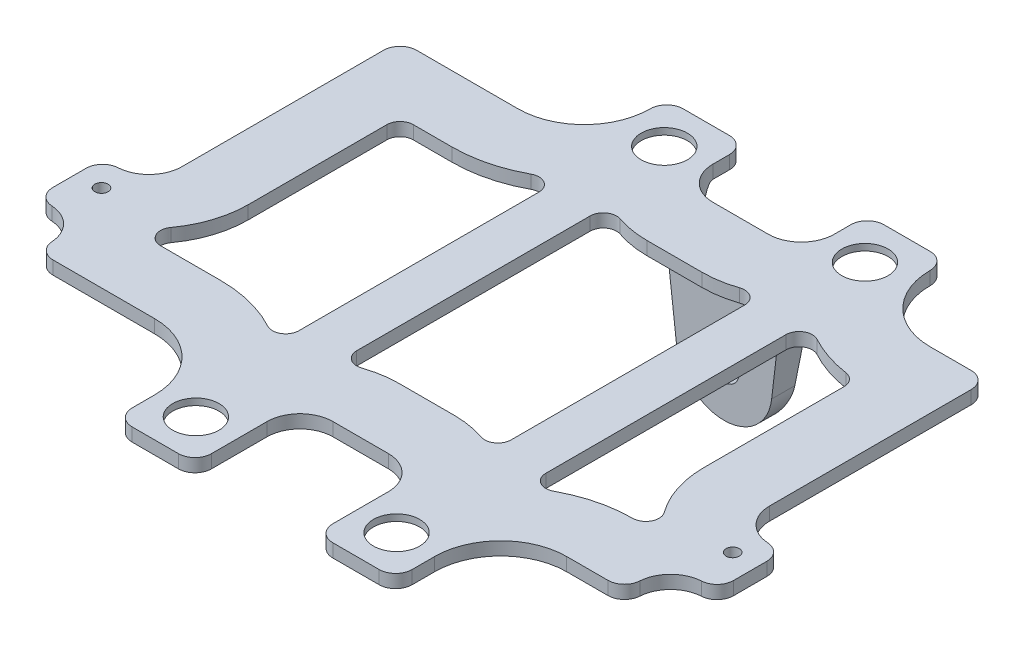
SolidWorks part; units mm, degrees
ref_plane "Front Plane" through (0, 0, 0) normal (0, 0, 1) x (1, 0, 0)
ref_plane "Top Plane" through (0, 0, 0) normal (0, 1, 0) x (1, 0, 0)
ref_plane "Right Plane" through (0, 0, 0) normal (1, 0, 0) x (0, 0, -1)
sketch "Sketch9"
  line L0 (46.99, 88.9) -> (46.99, 93.825) construction
  line L1 (32.2673, 87.1702) -> (116.9577, 87.1702) construction
  line L2 (116.9577, 87.1702) -> (116.9577, -2.8702) construction
  line L3 (116.9577, -2.8702) -> (32.2673, -2.8702) construction
  line L4 (46.99, 79.375) -> (46.99, 87.1702) construction
  line L5 (46.99, 87.1702) -> (102.235, 9.525) construction
  line L6 (102.235, 9.525) -> (102.235, -2.8702) construction
  line L7 (102.235, -2.8702) -> (102.235, 79.375) construction
  line L8 (46.99, 9.525) -> (46.99, 79.375) construction
  line L9 (46.99, 9.525) -> (46.99, -2.8702) construction
  line L10 (12.3317, 70.1675) -> (125.4125, 70.1675) construction
  line L11 (32.2673, 3.7846) -> (32.2673, 9.525) construction
  line L12 (32.2673, 80.5154) -> (32.2673, 79.375) construction
  line L13 (32.2673, 79.375) -> (32.2673, 70.1675) construction
  line L14 (32.2673, 9.525) -> (32.2673, 70.1675) construction
  line L15 (46.99, 8.509) -> (46.99, 9.525) construction
  line L16 (46.99, 9.525) -> (59.3217, 8.509) construction
  line L17 (59.3217, 8.509) -> (59.3217, 9.525) construction
  line L18 (102.235, 13.335) -> (102.235, 9.525) construction
  point P24 (102.235, 79.375)
other "AlignGroup1"
other "AlignGroup2"
other "AlignGroup3" parameters "D1"=0, "D2"=0, "D3"=19.5673, "D4"=77.2033, "D5"=89.535, "D6"=104.2577, "D7"=54.2925, "D8"=71.2952, "D9"=6.35, "D10"=7.366, "D11"=18.7452, "D12"=113.0808, "D13"=76.7308
other "AlignGroup4"
sketch "Sketch1" plane through (0, 0, 0) normal (0, 1, 0) x (1, 0, 0)
  line L0 (12.3317, 88.9) -> (12.3317, 0) construction
  line L1 (12.3317, 0) -> (119.8562, 0)
  line L2 (0, 0) -> (0, 88.9) construction
  line L3 (12.3317, 88.9) -> (119.8562, 88.9)
  line L4 (125.4125, 0) -> (125.4125, 88.9) construction
  line L5 (0, 88.9) -> (12.3317, 88.9) construction
  line L6 (0, 0) -> (12.3317, 0) construction
  line L7 (6.7754, 88.9) -> (6.7754, 0)
  line L8 (119.8562, 0) -> (119.8562, 88.9)
  line L9 (119.8562, 88.9) -> (125.4125, 88.9) construction
  line L10 (119.8562, 0) -> (125.4125, 0) construction
  line L11 (6.7754, 0) -> (12.3317, 0)
  line L12 (6.7754, 88.9) -> (12.3317, 88.9)
  dimension "D1" = 5.5562
  dimension "D2" = 88.9
  dimension "D3" = 5.5562
extrude "Boss-Extrude1" add sketch "Sketch1" along normal blind 2.54
sketch "Sketch2" plane through (0, 2.54, 0) normal (0, 1, 0) x (1, 0, 0)
  line L0 (6.7754, 0) -> (119.8562, 0) construction
  line L1 (6.7754, 88.9) -> (39.37, 88.9)
  line L2 (0, 88.9) -> (0, 79.375) construction
  line L3 (6.7754, 79.375) -> (39.37, 79.375)
  line L4 (39.37, 88.9) -> (39.37, 79.375)
  line L5 (119.8562, 88.9) -> (93.1862, 88.9)
  line L6 (119.8562, 88.9) -> (119.8562, 79.375)
  line L7 (119.8562, 79.375) -> (93.1862, 79.375)
  line L8 (93.1862, 88.9) -> (93.1862, 79.375)
  line L9 (119.8562, 0) -> (93.1862, 0)
  line L10 (119.8562, 0) -> (119.8562, 9.525)
  line L11 (119.8562, 9.525) -> (93.1862, 9.525)
  line L12 (93.1862, 0) -> (93.1862, 9.525)
  line L13 (39.37, 0) -> (6.7754, 0)
  line L14 (39.37, 0) -> (39.37, 9.525)
  line L15 (39.37, 9.525) -> (6.7754, 9.525)
  line L16 (0, 0) -> (0, 9.525) construction
  line L18 (39.37, 79.375) -> (39.37, 9.525) construction
  line L19 (93.1862, 9.525) -> (93.1862, 79.375) construction
  line L20 (93.1862, 9.525) -> (39.37, 9.525) construction
  line L21 (39.37, 79.375) -> (93.1862, 79.375) construction
  line L22 (119.8562, 88.9) -> (6.7754, 88.9) construction
  line L23 (77.9462, 9.525) -> (54.61, 9.525)
  line L24 (77.9462, 9.525) -> (77.9462, 0)
  line L25 (77.9462, 0) -> (54.61, 0)
  line L26 (54.61, 9.525) -> (54.61, 0)
  line L27 (54.61, 88.9) -> (77.9462, 88.9)
  line L28 (54.61, 88.9) -> (54.61, 79.375)
  line L29 (54.61, 79.375) -> (77.9462, 79.375)
  line L30 (77.9462, 88.9) -> (77.9462, 79.375)
  line L31 (77.9462, 9.525) -> (77.9462, 79.375) construction
  line L32 (54.61, 9.525) -> (54.61, 79.375) construction
  line L33 (6.7754, 88.9) -> (6.7754, 79.375)
  line L35 (6.7754, 9.525) -> (6.7754, 0)
  line L36 (6.7754, 9.525) -> (0, 9.525) construction
  line L37 (6.7754, 0) -> (0, 0) construction
  line L38 (0, 79.375) -> (6.7754, 79.375) construction
  line L39 (0, 88.9) -> (6.7754, 88.9) construction
  line L40 (0, 9.525) -> (0, 79.375) construction
  line L41 (6.7754, 88.9) -> (6.7754, 0) construction
  line L42 (119.8562, 0) -> (119.8562, 88.9) construction
  line L43 (6.7754, 0) -> (119.8562, 0) construction
  point P40 (66.2781, 9.525)
  dimension "D1" = 9.525
  dimension ".375" = 9.525
  dimension "D2" = 26.67
  dimension "D3" = 32.5946
  dimension "D4" = 15.24
extrude "Cut-Extrude1" cut sketch "Sketch2" against normal through all
sketch "Sketch4" plane through (0, 2.54, 0) normal (0, 1, 0) x (1, 0, 0)
  line L63 (59.9281, 0) -> (59.9281, 88.9) construction
  line L66 (152.7185, 14.2875) -> (143.1935, 14.2875) construction
  line L67 (154.306, 14.2875) -> (152.7185, 14.2875) construction
  line L68 (143.1935, 14.2875) -> (141.606, 14.2875) construction
  line L69 (152.7185, 20.32) -> (143.1935, 20.32) construction
  line L70 (154.306, 20.32) -> (152.7185, 20.32) construction
  line L71 (143.1935, 20.32) -> (141.606, 20.32) construction
  line L72 (152.7185, 26.3525) -> (143.1935, 26.3525) construction
  line L73 (154.306, 26.3525) -> (152.7185, 26.3525) construction
  line L74 (143.1935, 26.3525) -> (141.606, 26.3525) construction
  line L75 (152.7185, 32.385) -> (143.1935, 32.385) construction
  line L76 (154.306, 32.385) -> (152.7185, 32.385) construction
  line L77 (143.1935, 32.385) -> (141.606, 32.385) construction
  line L78 (152.7185, 38.4175) -> (143.1935, 38.4175) construction
  line L79 (154.306, 38.4175) -> (152.7185, 38.4175) construction
  line L80 (143.1935, 38.4175) -> (141.606, 38.4175) construction
  line L81 (152.7185, 44.45) -> (143.1935, 44.45) construction
  line L82 (154.306, 44.45) -> (152.7185, 44.45) construction
  line L83 (143.1935, 44.45) -> (141.606, 44.45) construction
  line L84 (152.7185, 50.4825) -> (143.1935, 50.4825) construction
  line L85 (154.306, 50.4825) -> (152.7185, 50.4825) construction
  line L86 (143.1935, 50.4825) -> (141.606, 50.4825) construction
  line L87 (152.7185, 56.515) -> (143.1935, 56.515) construction
  line L88 (154.306, 56.515) -> (152.7185, 56.515) construction
  line L89 (143.1935, 56.515) -> (141.606, 56.515) construction
  line L90 (152.7185, 62.5475) -> (143.1935, 62.5475) construction
  line L91 (154.306, 62.5475) -> (152.7185, 62.5475) construction
  line L92 (143.1935, 62.5475) -> (141.606, 62.5475) construction
  line L93 (152.7185, 68.58) -> (143.1935, 68.58) construction
  line L94 (154.306, 68.58) -> (152.7185, 68.58) construction
  line L95 (143.1935, 68.58) -> (141.606, 68.58) construction
  line L96 (152.7185, 74.6125) -> (143.1935, 74.6125) construction
  line L97 (154.306, 74.6125) -> (152.7185, 74.6125) construction
  line L98 (143.1935, 74.6125) -> (141.606, 74.6125) construction
  line L99 (154.306, 15.875) -> (141.606, 15.875) construction
  line L100 (141.606, 12.7) -> (154.306, 12.7) construction
  line L101 (154.306, 21.9075) -> (141.606, 21.9075) construction
  line L102 (141.606, 18.7325) -> (154.306, 18.7325) construction
  line L103 (154.306, 27.94) -> (141.606, 27.94) construction
  line L104 (141.606, 24.765) -> (154.306, 24.765) construction
  line L105 (154.306, 33.9725) -> (141.606, 33.9725) construction
  line L106 (141.606, 30.7975) -> (154.306, 30.7975) construction
  line L107 (154.306, 40.005) -> (141.606, 40.005) construction
  line L108 (141.606, 36.83) -> (154.306, 36.83) construction
  line L109 (154.306, 46.0375) -> (141.606, 46.0375) construction
  line L110 (141.606, 42.8625) -> (154.306, 42.8625) construction
  line L111 (154.306, 52.07) -> (141.606, 52.07) construction
  line L112 (141.606, 48.895) -> (154.306, 48.895) construction
  line L113 (154.306, 58.1025) -> (141.606, 58.1025) construction
  line L114 (141.606, 54.9275) -> (154.306, 54.9275) construction
  line L115 (154.306, 64.135) -> (141.606, 64.135) construction
  line L116 (141.606, 60.96) -> (154.306, 60.96) construction
  line L117 (154.306, 70.1675) -> (141.606, 70.1675) construction
  line L118 (141.606, 66.9925) -> (154.306, 66.9925) construction
  line L119 (154.306, 76.2) -> (141.606, 76.2) construction
  line L120 (141.606, 73.025) -> (154.306, 73.025) construction
  line L121 (77.9462, 0) -> (54.61, 0) construction
  line L122 (140.0185, 14.2875) -> (140.0185, 74.6125) construction
  line L123 (85.5662, 0) -> (85.5662, 17.4625) construction
  line L124 (77.9462, 0) -> (93.1862, 0) construction
  line L125 (85.5662, 17.4625) -> (85.5662, 71.4375) construction
  line L126 (85.5662, 71.4375) -> (85.5662, 88.9) construction
  line L127 (93.1862, 88.9) -> (77.9462, 88.9) construction
  arc A66 (143.1935, 14.2875) -> (141.606, 12.7) centre (141.606, 14.2875) cw construction
  arc A67 (141.606, 15.875) -> (143.1935, 14.2875) centre (141.606, 14.2875) cw construction
  arc A68 (152.7185, 14.2875) -> (154.306, 15.875) centre (154.306, 14.2875) cw construction
  arc A69 (154.306, 12.7) -> (152.7185, 14.2875) centre (154.306, 14.2875) cw construction
  arc A70 (143.1935, 20.32) -> (141.606, 18.7325) centre (141.606, 20.32) cw construction
  arc A71 (141.606, 21.9075) -> (143.1935, 20.32) centre (141.606, 20.32) cw construction
  arc A72 (152.7185, 20.32) -> (154.306, 21.9075) centre (154.306, 20.32) cw construction
  arc A73 (154.306, 18.7325) -> (152.7185, 20.32) centre (154.306, 20.32) cw construction
  arc A74 (143.1935, 26.3525) -> (141.606, 24.765) centre (141.606, 26.3525) cw construction
  arc A75 (141.606, 27.94) -> (143.1935, 26.3525) centre (141.606, 26.3525) cw construction
  arc A76 (152.7185, 26.3525) -> (154.306, 27.94) centre (154.306, 26.3525) cw construction
  arc A77 (154.306, 24.765) -> (152.7185, 26.3525) centre (154.306, 26.3525) cw construction
  arc A78 (143.1935, 32.385) -> (141.606, 30.7975) centre (141.606, 32.385) cw construction
  arc A79 (141.606, 33.9725) -> (143.1935, 32.385) centre (141.606, 32.385) cw construction
  arc A80 (152.7185, 32.385) -> (154.306, 33.9725) centre (154.306, 32.385) cw construction
  arc A81 (154.306, 30.7975) -> (152.7185, 32.385) centre (154.306, 32.385) cw construction
  arc A82 (143.1935, 38.4175) -> (141.606, 36.83) centre (141.606, 38.4175) cw construction
  arc A83 (141.606, 40.005) -> (143.1935, 38.4175) centre (141.606, 38.4175) cw construction
  arc A84 (152.7185, 38.4175) -> (154.306, 40.005) centre (154.306, 38.4175) cw construction
  arc A85 (154.306, 36.83) -> (152.7185, 38.4175) centre (154.306, 38.4175) cw construction
  arc A86 (143.1935, 44.45) -> (141.606, 42.8625) centre (141.606, 44.45) cw construction
  arc A87 (141.606, 46.0375) -> (143.1935, 44.45) centre (141.606, 44.45) cw construction
  arc A88 (152.7185, 44.45) -> (154.306, 46.0375) centre (154.306, 44.45) cw construction
  arc A89 (154.306, 42.8625) -> (152.7185, 44.45) centre (154.306, 44.45) cw construction
  arc A90 (143.1935, 50.4825) -> (141.606, 48.895) centre (141.606, 50.4825) cw construction
  arc A91 (141.606, 52.07) -> (143.1935, 50.4825) centre (141.606, 50.4825) cw construction
  arc A92 (152.7185, 50.4825) -> (154.306, 52.07) centre (154.306, 50.4825) cw construction
  arc A93 (154.306, 48.895) -> (152.7185, 50.4825) centre (154.306, 50.4825) cw construction
  arc A94 (143.1935, 56.515) -> (141.606, 54.9275) centre (141.606, 56.515) cw construction
  arc A95 (141.606, 58.1025) -> (143.1935, 56.515) centre (141.606, 56.515) cw construction
  arc A96 (152.7185, 56.515) -> (154.306, 58.1025) centre (154.306, 56.515) cw construction
  arc A97 (154.306, 54.9275) -> (152.7185, 56.515) centre (154.306, 56.515) cw construction
  arc A98 (143.1935, 62.5475) -> (141.606, 60.96) centre (141.606, 62.5475) cw construction
  arc A99 (141.606, 64.135) -> (143.1935, 62.5475) centre (141.606, 62.5475) cw construction
  arc A100 (152.7185, 62.5475) -> (154.306, 64.135) centre (154.306, 62.5475) cw construction
  arc A101 (154.306, 60.96) -> (152.7185, 62.5475) centre (154.306, 62.5475) cw construction
  arc A102 (143.1935, 68.58) -> (141.606, 66.9925) centre (141.606, 68.58) cw construction
  arc A103 (141.606, 70.1675) -> (143.1935, 68.58) centre (141.606, 68.58) cw construction
  arc A104 (152.7185, 68.58) -> (154.306, 70.1675) centre (154.306, 68.58) cw construction
  arc A105 (154.306, 66.9925) -> (152.7185, 68.58) centre (154.306, 68.58) cw construction
  arc A106 (143.1935, 74.6125) -> (141.606, 73.025) centre (141.606, 74.6125) cw construction
  arc A107 (141.606, 76.2) -> (143.1935, 74.6125) centre (141.606, 74.6125) cw construction
  arc A108 (152.7185, 74.6125) -> (154.306, 76.2) centre (154.306, 74.6125) cw construction
  arc A109 (154.306, 73.025) -> (152.7185, 74.6125) centre (154.306, 74.6125) cw construction
  arc A110 (141.606, 12.7) -> (141.606, 15.875) centre (141.606, 14.2875) cw construction
  arc A111 (154.306, 15.875) -> (154.306, 12.7) centre (154.306, 14.2875) cw construction
  arc A112 (141.606, 18.7325) -> (141.606, 21.9075) centre (141.606, 20.32) cw construction
  arc A113 (154.306, 21.9075) -> (154.306, 18.7325) centre (154.306, 20.32) cw construction
  arc A114 (141.606, 24.765) -> (141.606, 27.94) centre (141.606, 26.3525) cw construction
  arc A115 (154.306, 27.94) -> (154.306, 24.765) centre (154.306, 26.3525) cw construction
  arc A116 (141.606, 30.7975) -> (141.606, 33.9725) centre (141.606, 32.385) cw construction
  arc A117 (154.306, 33.9725) -> (154.306, 30.7975) centre (154.306, 32.385) cw construction
  arc A118 (141.606, 36.83) -> (141.606, 40.005) centre (141.606, 38.4175) cw construction
  arc A119 (154.306, 40.005) -> (154.306, 36.83) centre (154.306, 38.4175) cw construction
  arc A120 (141.606, 42.8625) -> (141.606, 46.0375) centre (141.606, 44.45) cw construction
  arc A121 (154.306, 46.0375) -> (154.306, 42.8625) centre (154.306, 44.45) cw construction
  arc A122 (141.606, 48.895) -> (141.606, 52.07) centre (141.606, 50.4825) cw construction
  arc A123 (154.306, 52.07) -> (154.306, 48.895) centre (154.306, 50.4825) cw construction
  arc A124 (141.606, 54.9275) -> (141.606, 58.1025) centre (141.606, 56.515) cw construction
  arc A125 (154.306, 58.1025) -> (154.306, 54.9275) centre (154.306, 56.515) cw construction
  arc A126 (141.606, 60.96) -> (141.606, 64.135) centre (141.606, 62.5475) cw construction
  arc A127 (154.306, 64.135) -> (154.306, 60.96) centre (154.306, 62.5475) cw construction
  arc A128 (141.606, 66.9925) -> (141.606, 70.1675) centre (141.606, 68.58) cw construction
  arc A129 (154.306, 70.1675) -> (154.306, 66.9925) centre (154.306, 68.58) cw construction
  arc A130 (141.606, 73.025) -> (141.606, 76.2) centre (141.606, 74.6125) cw construction
  arc A131 (154.306, 76.2) -> (154.306, 73.025) centre (154.306, 74.6125) cw construction
  point P8 (53.5781, 0)
  point P11 (66.2781, 0)
  point P214 (155.8935, 14.2875)
  point P215 (155.8935, 20.32)
  point P216 (155.8935, 26.3525)
  point P217 (155.8935, 32.385)
  point P218 (155.8935, 38.4175)
  point P219 (155.8935, 44.45)
  point P220 (155.8935, 50.4825)
  point P221 (155.8935, 56.515)
  point P222 (155.8935, 62.5475)
  point P223 (155.8935, 68.58)
  point P224 (155.8935, 74.6125)
  dimension "D7" = 6.35
  dimension "D8" = 6.35
sketch "Sketch5" plane through (0, 0, -79.375) normal (0, 0, -1) x (-1, 0, 0)
  line L0 (-77.9462, 0) -> (-77.9462, 2.54) construction
  line L1 (-54.61, 2.54) -> (-77.9462, 2.54)
  line L5 (-54.61, 2.54) -> (-77.9462, 2.54) construction
  line L6 (-77.9462, 2.54) -> (-77.9462, 0)
  line L7 (-77.9462, 0) -> (-75.4222, -21.3986)
  line L9 (-66.2781, 2.54) -> (-66.2781, 17.007) construction
  line L10 (-66.2781, 2.54) -> (-66.2781, -17.4625) construction
  line L11 (-54.61, 0) -> (-77.9462, 0) construction
  line L12 (-66.2781, -23.1775) -> (-66.2781, -25.273) construction
  line L13 (-54.61, 2.54) -> (-54.61, 0)
  line L14 (-54.61, 0) -> (-57.134, -21.3986)
  arc A0 (-75.4222, -21.3986) -> (-57.134, -21.3986) centre (-66.2781, -20.32) ccw
  circle A1 centre (-66.2781, -20.32) radius 2.8575
  dimension "D2" = 5.715
  dimension "D3" = 6.35
  dimension "D1" = 20.32
extrude "Boss-Extrude2" add sketch "Sketch5" along normal blind 3.175
sketch "Sketch10" plane through (0, 2.54, 0) normal (0, 1, 0) x (1, 0, 0)
  line L0 (6.7754, 79.375) -> (39.37, 79.375) construction
  line L1 (6.7754, 9.525) -> (3.9973, 9.525)
  line L2 (6.7754, 9.525) -> (6.7754, 79.375)
  line L3 (6.7754, 79.375) -> (3.9973, 79.375)
  line L4 (3.9973, 9.525) -> (3.9973, 79.375)
  dimension "D1" = 2.7781
extrude "Boss-Extrude3" add sketch "Sketch10" against normal up to vertex
sketch "Sketch12" plane through (0, 2.54, 0) normal (0, 1, 0) x (1, 0, 0)
  line L0 (77.9462, -10.6654) -> (54.61, -10.6654) construction
  line L1 (39.37, 0) -> (54.61, 0)
  line L2 (39.37, 0) -> (39.37, -10.6654)
  line L3 (39.37, -10.6654) -> (54.61, -10.6654)
  line L4 (54.61, 0) -> (54.61, -10.6654)
  line L5 (77.9462, 0) -> (93.1862, 0)
  line L6 (77.9462, 0) -> (77.9462, -10.6654)
  line L7 (77.9462, -10.6654) -> (93.1862, -10.6654)
  line L8 (93.1862, 0) -> (93.1862, -10.6654)
  line L9 (54.61, 88.9) -> (54.61, 82.55) construction
  line L10 (39.37, 88.9) -> (54.61, 88.9)
  line L11 (39.37, 88.9) -> (39.37, 95.25)
  line L12 (39.37, 95.25) -> (54.61, 95.25)
  line L13 (54.61, 88.9) -> (54.61, 95.25)
  line L14 (77.9462, 95.25) -> (93.1862, 95.25)
  line L15 (77.9462, 95.25) -> (77.9462, 88.9)
  line L16 (77.9462, 88.9) -> (93.1862, 88.9)
  line L17 (93.1862, 95.25) -> (93.1862, 88.9)
  line L18 (77.9462, 82.55) -> (77.9462, 88.9) construction
  line L19 (93.1862, 88.9) -> (77.9462, 88.9) construction
  dimension "D1" = 10.6654
  dimension "D2" = 6.35
  dimension "D3" = 6.35
extrude "Boss-Extrude4" add sketch "Sketch12" against normal up to surface (2.54 mm away) contours L6 L7 L8 L5
sketch "Sketch11" plane through (0, 2.54, 0) normal (0, 1, 0) x (1, 0, 0)
  line L0 (116.9577, 87.1702) -> (116.9577, -2.8702) construction
  line L1 (119.8562, 79.375) -> (116.9577, 79.375)
  line L2 (119.8562, 79.375) -> (119.8562, 9.525)
  line L3 (119.8562, 9.525) -> (116.9577, 9.525)
  line L4 (116.9577, 79.375) -> (116.9577, 9.525)
  line L5 (119.8562, 9.525) -> (93.1862, 9.525) construction
extrude "Cut-Extrude4" cut sketch "Sketch11" against normal through all
sketch "Sketch6"
  line L0 (39.37, -10.6654) -> (39.37, 9.525) construction
  line L1 (93.1862, 9.525) -> (93.1862, -10.6654) construction
  line L2 (46.99, 90.7721) -> (46.99, 95.25) construction
  line L3 (46.99, -10.2385) -> (85.5662, -10.2385) construction
  line L4 (85.5662, -10.2385) -> (85.5662, -7.3152) construction
  line L5 (85.5662, -2.8702) -> (85.5662, 87.1702) construction
  line L6 (93.1862, -10.6654) -> (77.9462, -10.6654) construction
  line L7 (85.5703, 40.8781) -> (46.9859, 40.8781) construction
  line L8 (77.9462, 95.25) -> (93.1862, 95.25) construction
  line L9 (54.61, 82.0488) -> (54.61, 82.55) construction
  line L10 (46.99, 87.1702) -> (85.5662, 87.1702) construction
  line L11 (85.5662, 95.25) -> (85.5662, 90.7721) construction
  line L12 (46.99, -2.8702) -> (46.99, -10.2385) construction
  line L13 (85.5662, -7.3152) -> (46.99, -7.3152) construction
  line L14 (66.2781, 40.8781) -> (66.2781, 77.7081) construction
  line L15 (46.99, -2.8702) -> (85.5662, -2.8702) construction
  line L16 (39.37, 79.375) -> (39.37, 95.25) construction
  line L17 (93.1862, 95.25) -> (93.1862, 79.375) construction
  line L20 (23.9329, 87.1702) -> (23.9329, -2.4433) construction
  line L21 (23.9329, -2.4433) -> (108.6233, -2.4433) construction
  line L22 (108.6233, -2.4433) -> (108.6233, 87.1702) construction
  line L23 (108.6233, 87.1702) -> (23.9329, 87.1702) construction
  line L24 (46.99, 87.1702) -> (85.5662, 87.1702) construction
  line L25 (85.5662, 87.1702) -> (85.5662, -2.8702) construction
  line L26 (85.5662, -2.8702) -> (46.99, -2.8702) construction
  line L29 (116.9577, 79.375) -> (116.9577, 9.525) construction
  line L30 (93.1862, 79.375) -> (116.9577, 79.375) construction
  circle A4 centre (46.99, -2.8702) radius 4.445
  circle A5 centre (85.5662, -2.8702) radius 4.445
  circle A6 centre (85.5662, 87.1702) radius 4.445
  circle A7 centre (46.99, 87.1702) radius 4.445
  point P6 (85.5662, -5.7606)
other "AlignGroup7" parameters "D1"=6.3714, "D3"=6.35, "D9"=8.89, "D2"=38.5762, "D4"=84.6904, "D5"=84.6904, "D6"=7.62, "D7"=0, "D8"=0, "D10"=8.3344, "D11"=50.6796, "D12"=62.3477, "D13"=93.0248, "D14"=15.875, "D15"=38.4969, "D16"=81.8183, "D17"=85.1356, "D18"=89.6135
other "AlignGroup8"
extrude "Cut-Extrude3" cut sketch "Sketch6" against normal up to next
sketch "Sketch13" plane through (0, 2.54, 0) normal (0, 1, 0) x (1, 0, 0)
  line L0 (3.9973, 79.375) -> (3.9973, 9.525) construction
  line L1 (3.9973, 31.115) -> (-4.9496, 31.115)
  line L2 (3.9973, 31.115) -> (3.9973, 18.415)
  line L3 (3.9973, 18.415) -> (-4.9496, 18.415)
  line L4 (-4.9496, 31.115) -> (-4.9496, 18.415)
  line L5 (0, 0) -> (-0.1871, 0) construction
  line L6 (116.9577, 79.375) -> (116.9577, 9.525) construction
  line L7 (116.9577, 31.115) -> (125.9046, 31.115)
  line L8 (116.9577, 31.115) -> (116.9577, 18.415)
  line L9 (116.9577, 18.415) -> (125.9046, 18.415)
  line L10 (125.9046, 31.115) -> (125.9046, 18.415)
  line L11 (-0.1871, 26.162) -> (-0.1871, 0) construction
  line L13 (39.37, 9.525) -> (3.9973, 9.525) construction
  line L14 (116.9577, 9.525) -> (93.1862, 9.525) construction
  circle A0 centre (-0.1871, 26.162) radius 1.27
  circle A1 centre (121.1421, 26.162) radius 1.27
  dimension "D1" = 2.54
  dimension "D2" = 12.7
  dimension "D3" = 8.9469
  dimension "D4" = 26.162
  dimension "D5" = 12.7
  dimension "D6" = 0.1871
  dimension "D7" = 121.1421
  dimension "D8" = 26.162
  dimension "D9" = 4.953
  dimension "D10" = 8.89
  dimension "D11" = 8.89
  dimension "D12" = 8.9469
extrude "Boss-Extrude5" add sketch "Sketch13" against normal up to surface (2.54 mm away)
fillet "Fillet2" radius 6.35 8 edges at (3.9973, 1.27, -31.115) (3.9973, 1.27, -18.415) (116.9577, 1.27, -18.415) (116.9577, 1.27, -31.115) (77.9462, 1.27, -82.55) (54.61, 1.27, -82.55) (54.61, 1.27, -9.525) (77.9462, 1.27, -9.525)
fillet "Fillet3" radius 12.7 4 edges at (39.37, 1.27, -79.375) (93.1862, 1.27, -79.375) (93.1862, 1.27, -9.525) (39.37, 1.27, -9.525)
fillet "Fillet4" radius 3.175 16 edges at (3.9973, 1.27, -79.375) (39.37, 1.27, -95.25) (54.61, 1.27, -95.25) (93.1862, 1.27, -95.25) (77.9462, 1.27, -95.25) (116.9577, 1.27, -79.375) (125.9046, 1.27, -31.115) (125.9046, 1.27, -18.415) (93.1862, 1.27, 10.6654) (77.9462, 1.27, 10.6654) (54.61, 1.27, 10.6654) (39.37, 1.27, 10.6654) (-4.9496, 1.27, -31.115) (-4.9496, 1.27, -18.415) (116.9577, 1.27, -9.525) (3.9973, 1.27, -9.525)
sketch "Sketch14" plane through (0, 0, 0) normal (0, -1, 0) x (1, 0, 0)
  circle A0 centre (46.99, 2.8702) radius 7.493
  circle A1 centre (85.5662, 2.8702) radius 7.493
  circle A2 centre (85.5662, -87.1702) radius 7.493
  circle A3 centre (46.99, -87.1702) radius 7.493
  dimension "D1" = 14.986
extrude "Cut-Extrude5" cut sketch "Sketch14" against normal blind 1.27
sketch "Sketch15" plane through (0, 2.54, 0) normal (0, 1, 0) x (1, 0, 0)
  line L0 (51.435, -2.8702) -> (81.1212, -2.8702) construction
  line L1 (90.0112, 87.1702) -> (90.0112, 72.2471) construction
  line L2 (81.1212, 87.1702) -> (81.1212, 72.4022) construction
  line L3 (51.435, 87.1702) -> (51.435, 72.4022) construction
  line L4 (42.545, 87.1702) -> (42.545, 72.2471) construction
  line L5 (90.0112, 16.6529) -> (90.0112, -2.8702) construction
  line L6 (81.1212, 19.6728) -> (81.1212, -2.8702) construction
  line L7 (51.435, 19.6728) -> (51.435, -2.8702) construction
  line L8 (42.545, 16.6529) -> (42.545, -2.8702) construction
  line L41 (42.545, 87.1702) -> (51.435, 87.1702) construction
  line L42 (42.545, 72.2471) -> (42.545, 16.6529)
  line L43 (42.545, -2.8702) -> (51.435, -2.8702) construction
  line L44 (51.435, 72.4022) -> (51.435, 19.6728)
  line L45 (81.1212, 87.1702) -> (90.0112, 87.1702) construction
  line L46 (81.1212, 72.4022) -> (81.1212, 19.6728)
  line L47 (81.1212, -2.8702) -> (90.0112, -2.8702) construction
  line L48 (90.0112, 72.2471) -> (90.0112, 16.6529)
  line L60 (26.67, 66.675) -> (16.6973, 66.675)
  line L61 (16.6973, 66.675) -> (16.6973, 37.465)
  line L62 (13.7618, 22.225) -> (26.67, 22.225)
  line L63 (60.96, 22.225) -> (71.5962, 22.225)
  line L64 (105.8862, 22.225) -> (107.1932, 22.225)
  line L65 (104.2577, 37.465) -> (104.2577, 66.7273)
  line L66 (71.5962, 69.85) -> (60.96, 69.85)
  line L67 (26.67, 66.675) -> (16.6973, 66.675)
  line L68 (16.6973, 66.675) -> (16.6973, 37.465)
  line L69 (13.7618, 22.225) -> (26.67, 22.225)
  line L70 (60.96, 22.225) -> (71.5962, 22.225)
  line L71 (105.8862, 22.225) -> (107.1932, 22.225)
  line L72 (104.2577, 37.465) -> (104.2577, 66.7273)
  line L73 (71.5962, 69.85) -> (60.96, 69.85)
  arc A0 (46.6223, 76.3567) -> (51.435, 72.4022) centre (60.96, 88.9) ccw construction
  arc A1 (42.545, 72.2471) -> (46.6223, 76.3567) centre (26.67, 92.075) ccw construction
  arc A2 (81.1212, 72.4022) -> (85.9339, 76.3567) centre (71.5962, 88.9) ccw construction
  arc A3 (85.9339, 76.3567) -> (90.0112, 72.2471) centre (105.8862, 92.075) ccw construction
  arc A4 (51.435, 19.6728) -> (45.3268, 14.0611) centre (60.96, 3.175) ccw construction
  arc A5 (45.3268, 14.0611) -> (42.545, 16.6529) centre (26.67, -3.175) ccw construction
  arc A6 (87.2294, 14.0611) -> (81.1212, 19.6728) centre (71.5962, 3.175) ccw construction
  arc A7 (90.0112, 16.6529) -> (87.2294, 14.0611) centre (105.8862, -3.175) ccw construction
  circle A56 centre (46.99, 87.1702) radius 4.445 construction
  circle A57 centre (46.99, -2.8702) radius 4.445 construction
  circle A58 centre (85.5662, 87.1702) radius 4.445 construction
  circle A59 centre (85.5662, -2.8702) radius 4.445 construction
  arc A84 (11.8464, 24.765) -> (16.6973, 37.465) centre (-2.3527, 37.465) ccw
  arc A85 (45.3268, 14.0611) -> (26.67, 22.225) centre (26.67, -3.175) ccw
  arc A86 (60.96, 22.225) -> (45.3268, 14.0611) centre (60.96, 3.175) ccw
  arc A87 (87.2294, 14.0611) -> (71.5962, 22.225) centre (71.5962, 3.175) ccw
  arc A88 (105.8862, 22.225) -> (87.2294, 14.0611) centre (105.8862, -3.175) ccw
  arc A89 (104.2577, 37.465) -> (109.1087, 24.765) centre (123.3077, 37.465) ccw
  arc A90 (85.9339, 76.3567) -> (104.2577, 66.7273) centre (105.8862, 92.075) ccw
  arc A91 (71.5962, 69.85) -> (85.9339, 76.3567) centre (71.5962, 88.9) ccw
  arc A92 (46.6223, 76.3567) -> (60.96, 69.85) centre (60.96, 88.9) ccw
  arc A93 (26.67, 66.675) -> (46.6223, 76.3567) centre (26.67, 92.075) ccw
  arc A94 (11.8464, 24.765) -> (16.6973, 37.465) centre (-2.3527, 37.465) ccw
  arc A95 (42.545, 16.6529) -> (26.67, 22.225) centre (26.67, -3.175) ccw
  arc A96 (60.96, 22.225) -> (51.435, 19.6728) centre (60.96, 3.175) ccw
  arc A97 (81.1212, 19.6728) -> (71.5962, 22.225) centre (71.5962, 3.175) ccw
  arc A98 (105.8862, 22.225) -> (90.0112, 16.6529) centre (105.8862, -3.175) ccw
  arc A99 (104.2577, 37.465) -> (109.1087, 24.765) centre (123.3077, 37.465) ccw
  arc A100 (90.0112, 72.2471) -> (104.2577, 66.7273) centre (105.8862, 92.075) ccw
  arc A101 (71.5962, 69.85) -> (81.1212, 72.4022) centre (71.5962, 88.9) ccw
  arc A102 (51.435, 72.4022) -> (60.96, 69.85) centre (60.96, 88.9) ccw
  arc A103 (26.67, 66.675) -> (42.545, 72.2471) centre (26.67, 92.075) ccw
  arc A112 (13.7618, 22.225) -> (11.8464, 24.765) centre (-2.3527, 12.065) ccw
  arc A113 (13.7618, 22.225) -> (11.8464, 24.765) centre (-2.3527, 12.065) ccw
  arc A114 (109.1087, 24.765) -> (107.1932, 22.225) centre (123.3077, 12.065) ccw
  arc A115 (109.1087, 24.765) -> (107.1932, 22.225) centre (123.3077, 12.065) ccw
  point P16 (85.5662, -2.8702)
  point P18 (46.99, -2.8702)
  dimension "D1" = 12.7
extrude "Cut-Extrude6" cut sketch "Sketch15" against normal through all
fillet "Fillet5" radius 2.54 14 edges at (104.2577, 1.27, -66.7273) (90.0112, 1.27, -72.2471) (81.1212, 1.27, -72.4022) (51.435, 1.27, -72.4022) (90.0112, 1.27, -16.6529) (51.435, 1.27, -19.6728) (81.1212, 1.27, -19.6728) (42.545, 1.27, -16.6529) (42.545, 1.27, -72.2471) (16.6973, 1.27, -66.675) (107.1932, 1.27, -22.225) (109.1087, 1.27, -24.765) (13.7618, 1.27, -22.225) (11.8464, 1.27, -24.765)
